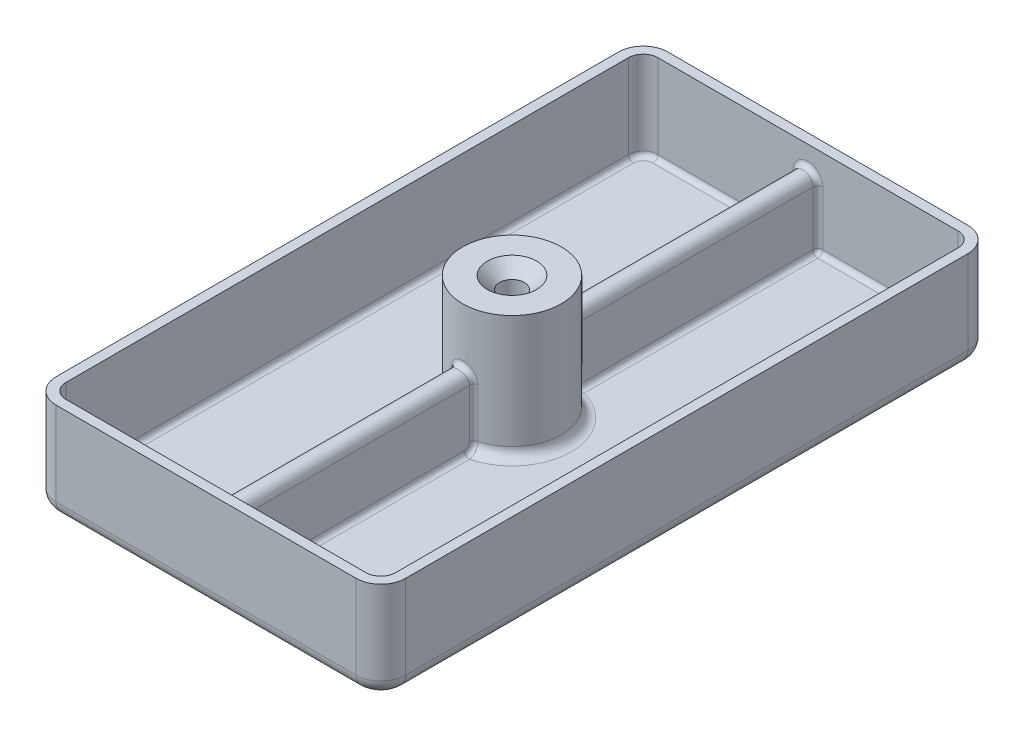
SolidWorks part; units mm, degrees
ref_plane "Front" through (0, 0, 0) normal (0, 0, 1) x (1, 0, 0)
ref_plane "Top" through (0, 0, 0) normal (0, 1, 0) x (1, 0, 0)
ref_plane "Right" through (0, 0, 0) normal (1, 0, 0) x (0, 0, -1)
sketch "Sketch1" plane through (0, 0, 0) normal (0, 1, 0) x (1, 0, 0)
  line L0 (-35.4102, -62.0052) -> (35.4102, -62.0052)
  line L1 (-35.4102, -62.0052) -> (-35.4102, 62.0052)
  line L2 (35.4102, 62.0052) -> (-35.4102, 62.0052)
  line L3 (35.4102, 62.0052) -> (35.4102, -62.0052)
  line L4 (-35.4102, 62.0052) -> (35.4102, -62.0052) construction
  point P5 (0, 0)
  dimension "D1" = 124.0104
  dimension "D2" = 70.8205
extrude "Base-Extrude" add sketch "Sketch1" along normal blind 20
fillet "Fillet1" radius 5 4 edges at (-35.4102, 10, 62.0052) (35.4102, 10, 62.0052) (35.4102, 10, -62.0052) (-35.4102, 10, -62.0052)
fillet "Fillet2" radius 3 8 edges at (-35.4102, 0, 0) (0, 0, -62.0052) (35.4102, 0, 0) (0, 0, 62.0052) (33.9458, 0, -60.5407) (33.9458, 0, 60.5407) (-33.9458, 0, 60.5407) (-33.9458, 0, -60.5407)
shell "Shell1" thickness 2
sketch "Sketch2" plane through (0, 0, 0) normal (0, 0, 1) x (1, 0, 0)
  line L0 (0, 0) -> (0, 23.9525) construction
  line L1 (-2, 2) -> (-2, 14)
  line L2 (30.4102, 2) -> (-30.4102, 2) construction
  line L3 (2, 14) -> (2, 2)
  line L4 (2, 2) -> (-2, 2)
  arc A0 (-2, 14) -> (2, 14) centre (0, 14) cw
  dimension "D1" = 2
  dimension "D2" = 12
extrude "Rib" add sketch "Sketch2" along normal up to next and the other way up to next
sketch "Sketch3" plane through (0, 2, 0) normal (0, 1, 0) x (-1, 0, 0)
  circle A0 centre (0, 0) radius 10
  dimension "D1" = 20
extrude "CylBoss" add sketch "Sketch3" along normal blind 25
fillet "Fillet4" radius 2 2 edges at (10, 2, 0) (-10, 2, 0)
fillet "Fillet5" radius 1 24 edges at (2, 9, -9.798) (-0.455, 12.0524, 9.9896) (-2, 9, 9.798) (-0.455, 15.9476, -9.9896) (2, 9, 9.798) (-2, 9, -9.798) (2, 2, -35.4187) (2, 2.7686, -10.2304) (2, 2.4508, 10.5472) (-2, 2.7686, 10.2304) (-2, 2, -35.4187) (-2, 2.4508, -10.5472) (-2, 8.5, -60.0052) (-2, 2.2929, 59.7123) (0, 16, -60.0052) (2, 2.2929, 59.7123) (2, 2, 35.4187) (2, 8.5, -60.0052) (-2, 2, 35.4187) (2, 8.5, 60.0052) (0, 16, 60.0052) (-2, 8.5, 60.0052) (-2, 2.2929, -59.7123) (2, 2.2929, -59.7123)
hole_wizard "CounterSnk" positions "Sketch4" profile "Sketch5" legacy
sketch "Sketch4" plane through (0, 27, 0) normal (0, 1, 0) x (-1, 0, 0)
  point P0 (0, 0)
sketch "Sketch5" plane through (0, 27, 0) normal (1, 0, 0) x (0, 0, 1)
  line L0 (0, 0) -> (0, 27)
  line L1 (0, 27) -> (2.5, 27)
  line L2 (2.5, 27) -> (2.5, 2.5)
  line L3 (2.5, 2.5) -> (5, 0)
  line L4 (5, 0) -> (0, 0)
  line L5 (0, 116.4889) -> (0, 0) construction
